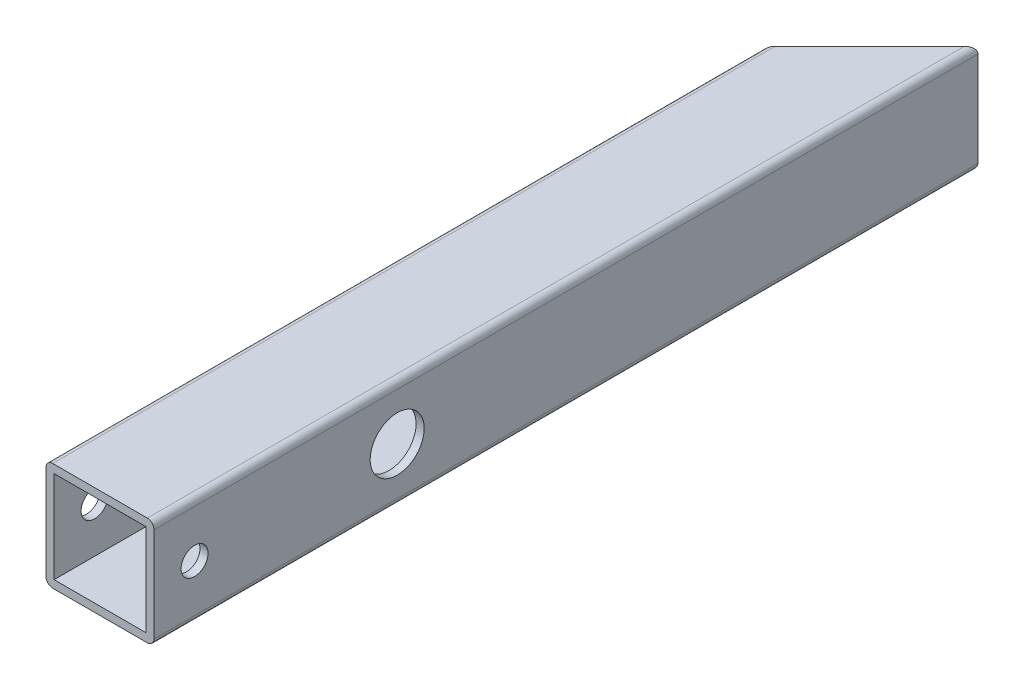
SolidWorks part; units mm, degrees
ref_plane "Plan de face" through (0, 0, 0) normal (0, 0, 1) x (1, 0, 0)
ref_plane "Plan de dessus" through (0, 0, 0) normal (0, 1, 0) x (1, 0, 0)
ref_plane "Plan de droite" through (0, 0, 0) normal (1, 0, 0) x (0, 0, -1)
sketch "Esquisse1" plane through (0, 0, 0) normal (0, 0, 1) x (1, 0, 0)
  line L1 (0, 0) -> (80, 0)
  line L2 (0, 0) -> (0, -80)
  line L3 (0, -80) -> (80, -80)
  line L4 (80, 0) -> (80, -80)
  dimension "D1" = 80
  dimension "D2" = 80
extrude "Extru.-Mince1" add sketch "Esquisse1" along normal blind 610 thin
sketch "Esquisse2" plane through (0, 0, 0) normal (0, 1, 0) x (-1, 0, 0)
  line L0 (-80, 0) -> (0, 0)
  line L1 (0, 0) -> (0, 80)
  line L2 (0, 610) -> (0, 0) construction
  line L3 (0, 80) -> (-80, 0)
  dimension "D1" = 80
extrude "Enlèv. mat.-Extru.1" cut sketch "Esquisse2" against normal through all
sketch "Esquisse3" plane through (80, 0, 0) normal (1, 0, 0) x (0, 0, -1)
  line L0 (-610, -80) -> (-610, 0) construction
  line L1 (-610, 0) -> (0, 0) construction
  circle A0 centre (-580, -40) radius 10
  circle A1 centre (-430, -40) radius 20
  dimension "D3" = 40
  dimension "D4" = 20
  dimension "D1" = 30
  dimension "D2" = 150
  dimension "D5" = 40
  dimension "D6" = 40
extrude "Enlèv. mat.-Extru.2" cut sketch "Esquisse3" against normal through all
fillet "Congé1" radius 5 4 edges at (0, -80, 345) (80, -80, 305) (0, 0, 345) (80, 0, 305)
